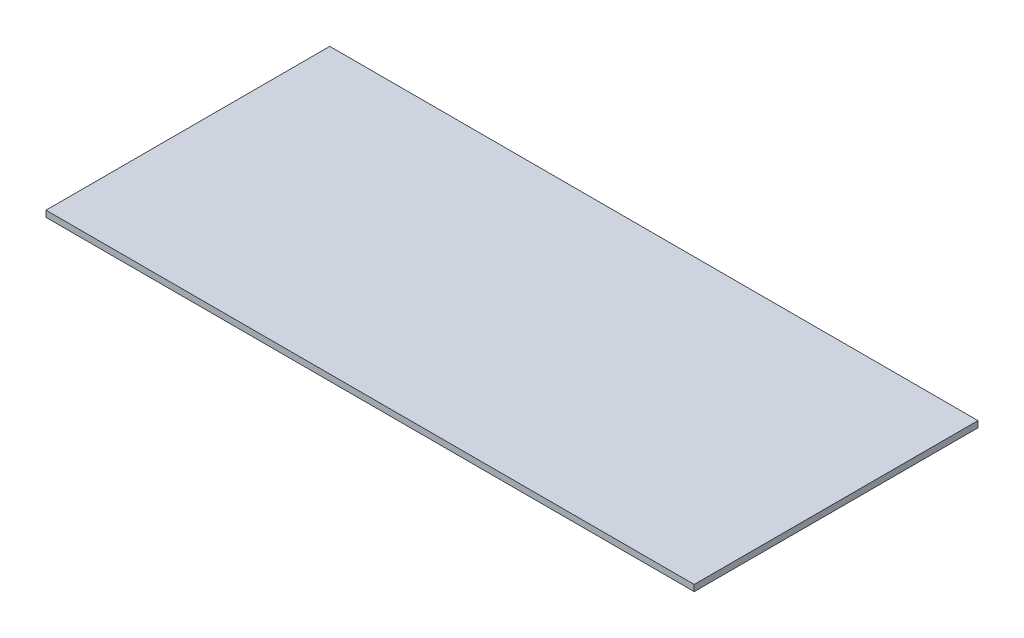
SolidWorks part; units mm, degrees
ref_plane "Front Plane" through (0, 0, 0) normal (0, 0, 1) x (1, 0, 0)
ref_plane "Top Plane" through (0, 0, 0) normal (0, 1, 0) x (1, 0, 0)
ref_plane "Right Plane" through (0, 0, 0) normal (1, 0, 0) x (0, 0, -1)
sketch "Sketch1" plane through (0, 0, 0) normal (0, 1, 0) x (1, 0, 0)
  line L1 (-77.6682, -34) -> (77.6682, -34)
  line L2 (-77.6682, -34) -> (-77.6682, 34)
  line L3 (-77.6682, 34) -> (77.6682, 34)
  line L4 (77.6682, -34) -> (77.6682, 34)
  line L5 (-77.6682, -34) -> (77.6682, 34) construction
  line L6 (-77.6682, 34) -> (77.6682, -34) construction
  point P0 (0, 0)
  dimension "D1" = 68
  dimension "D2" = 155.3365
base flange "Base-Flange1" sketch "Sketch1" thickness 1.5 reverse thickness direction no parameters "D1"=5
sketch "Bend-Lines1" [suppressed] plane through (0, 0, 0) normal (0, 1, 0) x (1, 0, 0)
sketch "Bounding-Box1" [suppressed] plane through (0, 0, 0) normal (0, 1, 0) x (1, 0, 0)
sheet metal parameters "Sheet-Metal1" thickness 1.5 parameters "D1"=5
flat pattern "Flat-Pattern1"
sketch "Bend-Lines2" plane through (0, 0, 0) normal (0, 1, 0) x (1, 0, 0)
sketch3d "Bounding-Box2" [suppressed]
  line L0 (-77.6682, 34, 0) -> (77.6682, 34, 0) construction
  line L1 (-77.6682, -34, 0) -> (77.6682, -34, 0) construction
  line L2 (-77.6682, 34, 0) -> (-77.6682, -34, 0) construction
  line L3 (77.6682, 34, 0) -> (77.6682, -34, 0) construction
